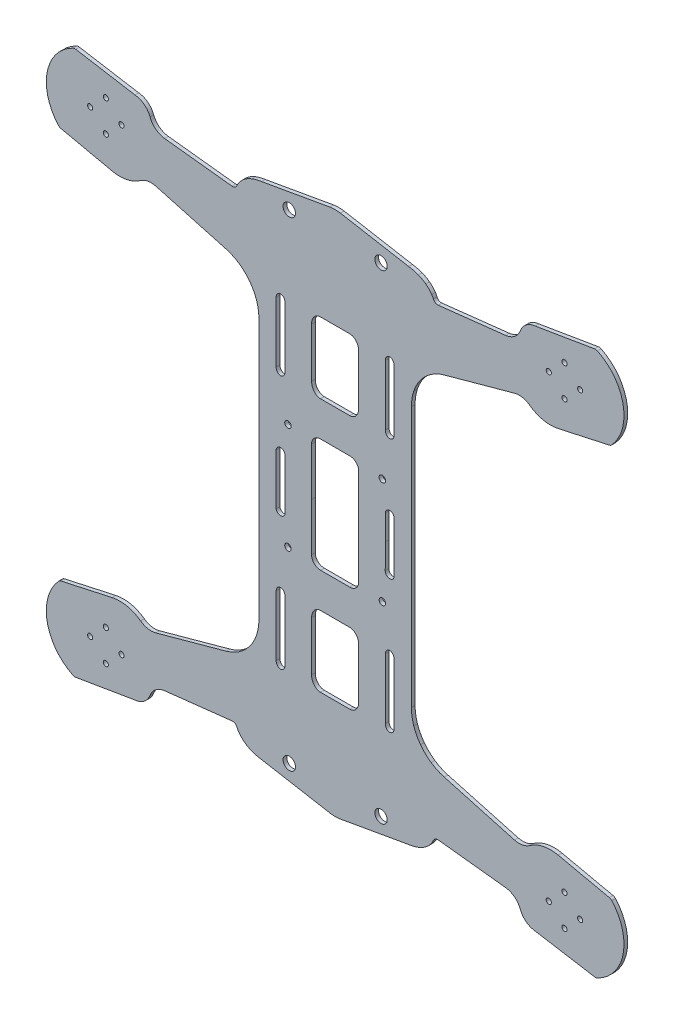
SolidWorks part; units mm, degrees
ref_plane "Спереди" through (0, 0, 0) normal (0, 0, 1) x (1, 0, 0)
ref_plane "Сверху" through (0, 0, 0) normal (0, 1, 0) x (1, 0, 0)
ref_plane "Справа" through (0, 0, 0) normal (1, 0, 0) x (0, 0, -1)
sketch "Эскиз1" plane through (0, 0, 0) normal (0, 0, 1) x (1, 0, 0)
  line L0 (-48.6059, 52.4299) -> (-29.5522, 47.1849)
  line L1 (0, 0) -> (0, 94.9232) construction
  line L2 (-74.3015, 53.0966) -> (-60.4307, 50.0534)
  line L3 (-54.2578, 71.013) -> (-70.2978, 73.7013)
  line L4 (-20.6558, 0) -> (-20.6558, -35.3014)
  line L5 (-15.992, 0) -> (-15.992, -7.0144)
  line L6 (15.992, 6.8016) -> (15.992, 0)
  line L7 (13.592, 0) -> (13.592, 6.8016)
  line L8 (15.992, 42.6106) -> (15.992, 26.2906)
  line L9 (13.592, 26.2906) -> (13.592, 42.6106)
  line L10 (-6.392, 0) -> (-6.3923, -13.0023)
  line L11 (48.6059, -52.4299) -> (29.5522, -47.1849)
  line L12 (1.4357, 71.1085) -> (19.9392, 67.8359)
  line L13 (-3.992, 15.4016) -> (3.992, 15.4016)
  line L14 (74.3015, -53.0966) -> (60.4307, -50.0534)
  line L15 (54.2578, -71.013) -> (70.2978, -73.7013)
  line L16 (6.392, 13.0016) -> (6.392, 0)
  line L17 (46.2218, -64.8102) -> (27.9448, -62.7571)
  line L18 (6.392, -41.1706) -> (6.392, -27.7306)
  line L19 (-3.992, -44.0506) -> (3.992, -44.0506)
  line L20 (-3.992, -24.8506) -> (3.992, -24.8506)
  line L21 (-3.992, 24.8506) -> (3.992, 24.8506)
  line L22 (-3.992, 44.0506) -> (3.992, 44.0506)
  line L23 (-3.9532, -15.4016) -> (3.9532, -15.4016)
  line L24 (6.392, 41.1706) -> (6.392, 27.7306)
  line L25 (46.2218, 64.8102) -> (27.9448, 62.7571)
  line L26 (1.3462, -71.1243) -> (19.9392, -67.8359)
  line L27 (20.6558, 35.3014) -> (20.6558, 0)
  line L28 (13.592, -26.2906) -> (13.592, -42.6106)
  line L29 (15.992, -42.6106) -> (15.992, -26.2906)
  line L30 (13.592, 0) -> (13.5753, -6.731)
  line L31 (6.392, 0) -> (6.3923, -13.0023)
  line L32 (15.992, 0) -> (15.992, -7.0144)
  line L33 (20.6558, 0) -> (20.6558, -35.3014)
  line L34 (-13.592, 0) -> (-13.5753, -6.731)
  line L35 (-15.992, -42.6106) -> (-15.992, -26.2906)
  line L36 (54.2578, 71.013) -> (70.2978, 73.7013)
  line L37 (74.3015, 53.0966) -> (60.4307, 50.0534)
  line L38 (48.6059, 52.4299) -> (29.5522, 47.1849)
  line L39 (-13.592, -26.2906) -> (-13.592, -42.6106)
  line L40 (-20.6558, 35.3014) -> (-20.6558, 0)
  line L41 (-1.3462, -71.1243) -> (-19.9392, -67.8359)
  line L42 (-46.2218, 64.8102) -> (-27.9448, 62.7571)
  line L43 (-6.392, 41.1706) -> (-6.392, 27.7306)
  line L44 (-6.392, -41.1706) -> (-6.392, -27.7306)
  line L45 (-46.2218, -64.8102) -> (-27.9448, -62.7571)
  line L46 (-6.392, 13.0016) -> (-6.392, 0)
  line L47 (-54.2578, -71.013) -> (-70.2978, -73.7013)
  line L48 (0, 0) -> (0, 62.4198) construction
  line L49 (0, 0) -> (0, -77.9632) construction
  line L50 (-74.3015, -53.0966) -> (-60.4307, -50.0534)
  line L51 (-1.4357, 71.1085) -> (-19.9392, 67.8359)
  line L52 (-48.6059, -52.4299) -> (-29.5522, -47.1849)
  line L53 (-13.592, 26.2906) -> (-13.592, 42.6106)
  line L54 (-15.992, 42.6106) -> (-15.992, 26.2906)
  line L55 (-13.592, 0) -> (-13.592, 6.8016)
  line L56 (-15.992, 6.8016) -> (-15.992, 0)
  circle A0 centre (62.15, 62.15) radius 4.25 construction
  circle A1 centre (62.1497, 66.3982) radius 0.7
  circle A2 centre (12.792, 14.4016) radius 0.88
  circle A3 centre (62.15, -62.15) radius 4.25 construction
  circle A4 centre (66.3996, 62.1502) radius 0.7
  circle A5 centre (57.8979, 62.1495) radius 0.7
  arc A6 (54.2578, -71.013) -> (50.1846, -67.906) centre (54.6832, -66.2318) cw
  arc A7 (15.992, 6.8016) -> (13.592, 6.8016) centre (14.792, 6.8016) ccw
  circle A8 centre (12.437, 64.959) radius 1.68
  arc A9 (1.4357, 71.1085) -> (0, 71.2263) centre (0, 62.4198) ccw
  circle A10 centre (62.1498, 57.9) radius 0.7
  arc A11 (6.392, 13.0016) -> (3.992, 15.4016) centre (3.992, 13.0016) ccw
  arc A12 (46.2218, -64.8102) -> (50.1846, -67.906) centre (45.686, -69.5802) cw
  arc A13 (52.711, -51.6782) -> (48.6059, -52.4299) centre (49.8798, -47.802) cw
  arc A14 (26.6179, 63.5428) -> (27.9448, 62.7571) centre (27.8019, 64.0291) ccw
  arc A15 (26.6179, 63.5428) -> (26.1583, 64.4009) centre (22.1961, 61.7266) ccw
  arc A16 (26.1583, 64.4009) -> (24.5827, 66.0547) centre (20.4789, 60.5676) ccw
  arc A17 (24.5827, 66.0547) -> (22.5371, 67.1835) centre (19.4941, 59.2508) ccw
  arc A18 (22.5371, 67.1835) -> (19.9392, 67.8359) centre (18.5376, 56.7573) ccw
  arc A19 (29.5522, 47.1849) -> (26.0037, 45.5429) centre (32.6592, 35.8153) ccw
  arc A20 (26.0037, 45.5429) -> (23.1369, 42.7956) centre (32.8673, 35.5111) ccw
  arc A21 (23.1369, 42.7956) -> (21.2954, 39.2686) centre (33.0435, 35.3792) ccw
  arc A22 (21.2954, 39.2686) -> (20.6558, 35.3014) centre (33.2785, 35.3014) ccw
  arc A23 (52.711, -51.6782) -> (60.4307, -50.0534) centre (58.3734, -59.4304) cw
  arc A24 (74.3015, -53.0966) -> (74.9766, -53.4883) centre (74.0272, -54.3468) cw
  arc A25 (74.9766, -53.4883) -> (71.0679, -73.5906) centre (65.4826, -62.0735) cw
  arc A26 (71.0679, -73.5906) -> (70.2978, -73.7013) centre (70.5094, -72.4389) cw
  arc A27 (21.2954, -39.2686) -> (20.6558, -35.3014) centre (33.2785, -35.3014) cw
  arc A28 (23.1369, -42.7956) -> (21.2954, -39.2686) centre (33.0435, -35.3792) cw
  arc A29 (26.0037, -45.5429) -> (23.1369, -42.7956) centre (32.8673, -35.5111) cw
  arc A30 (29.5522, -47.1849) -> (26.0037, -45.5429) centre (32.6592, -35.8153) cw
  arc A31 (22.5371, -67.1835) -> (19.9392, -67.8359) centre (18.5376, -56.7573) cw
  arc A32 (24.5827, -66.0547) -> (22.5371, -67.1835) centre (19.4941, -59.2508) cw
  arc A33 (26.1583, -64.4009) -> (24.5827, -66.0547) centre (20.4789, -60.5676) cw
  arc A34 (26.6179, -63.5428) -> (26.1583, -64.4009) centre (22.1961, -61.7266) cw
  arc A35 (26.6179, -63.5428) -> (27.9448, -62.7571) centre (27.8019, -64.0291) cw
  arc A36 (6.3923, -13.0023) -> (3.9532, -15.4016) centre (3.992, -13.0016) cw
  circle A37 centre (62.1498, -57.9) radius 0.7
  arc A38 (1.3462, -71.1243) -> (0, -71.2278) centre (0, -62.4198) cw
  circle A39 centre (12.437, -64.959) radius 1.68
  arc A40 (15.992, -7.0144) -> (13.5753, -6.731) centre (14.792, -6.8016) cw
  circle A41 centre (57.8979, -62.1495) radius 0.7
  circle A42 centre (66.3996, -62.1502) radius 0.7
  circle A43 centre (12.792, -14.4016) radius 0.88
  circle A44 centre (62.1497, -66.3982) radius 0.7
  circle A45 centre (-62.15, -62.15) radius 4.25 construction
  circle A46 centre (-62.15, 62.15) radius 4.25 construction
  arc A47 (-54.2578, 71.013) -> (-50.1846, 67.906) centre (-54.6832, 66.2318) cw
  arc A48 (-46.2218, 64.8102) -> (-50.1846, 67.906) centre (-45.686, 69.5802) cw
  arc A49 (-52.711, 51.6782) -> (-48.6059, 52.4299) centre (-49.8798, 47.802) cw
  arc A50 (-52.711, 51.6782) -> (-60.4307, 50.0534) centre (-58.3734, 59.4304) cw
  arc A51 (-74.3015, 53.0966) -> (-74.9766, 53.4883) centre (-74.0272, 54.3468) cw
  arc A52 (-74.9766, 53.4883) -> (-71.0679, 73.5906) centre (-65.4826, 62.0735) cw
  arc A53 (-71.0679, 73.5906) -> (-70.2978, 73.7013) centre (-70.5094, 72.4389) cw
  circle A54 centre (-62.1497, -66.3982) radius 0.7
  circle A55 centre (-12.792, -14.4016) radius 0.88
  circle A56 centre (-66.3996, -62.1502) radius 0.7
  arc A57 (71.0679, 73.5906) -> (70.2978, 73.7013) centre (70.5094, 72.4389) ccw
  arc A58 (74.9766, 53.4883) -> (71.0679, 73.5906) centre (65.4826, 62.0735) ccw
  arc A59 (74.3015, 53.0966) -> (74.9766, 53.4883) centre (74.0272, 54.3468) ccw
  arc A60 (52.711, 51.6782) -> (60.4307, 50.0534) centre (58.3734, 59.4304) ccw
  arc A61 (52.711, 51.6782) -> (48.6059, 52.4299) centre (49.8798, 47.802) ccw
  arc A62 (46.2218, 64.8102) -> (50.1846, 67.906) centre (45.686, 69.5802) ccw
  arc A63 (54.2578, 71.013) -> (50.1846, 67.906) centre (54.6832, 66.2318) ccw
  circle A64 centre (-57.8979, -62.1495) radius 0.7
  arc A65 (-15.992, -7.0144) -> (-13.5753, -6.731) centre (-14.792, -6.8016) ccw
  circle A66 centre (-12.437, -64.959) radius 1.68
  arc A67 (-1.3462, -71.1243) -> (0, -71.2278) centre (0, -62.4198) ccw
  circle A68 centre (-62.1498, -57.9) radius 0.7
  arc A69 (-6.3923, -13.0023) -> (-3.9532, -15.4016) centre (-3.992, -13.0016) ccw
  arc A70 (-26.6179, -63.5428) -> (-27.9448, -62.7571) centre (-27.8019, -64.0291) ccw
  arc A71 (-26.6179, -63.5428) -> (-26.1583, -64.4009) centre (-22.1961, -61.7266) ccw
  arc A72 (-26.1583, -64.4009) -> (-24.5827, -66.0547) centre (-20.4789, -60.5676) ccw
  arc A73 (-24.5827, -66.0547) -> (-22.5371, -67.1835) centre (-19.4941, -59.2508) ccw
  arc A74 (-22.5371, -67.1835) -> (-19.9392, -67.8359) centre (-18.5376, -56.7573) ccw
  arc A75 (-29.5522, -47.1849) -> (-26.0037, -45.5429) centre (-32.6592, -35.8153) ccw
  arc A76 (-26.0037, -45.5429) -> (-23.1369, -42.7956) centre (-32.8673, -35.5111) ccw
  arc A77 (-23.1369, -42.7956) -> (-21.2954, -39.2686) centre (-33.0435, -35.3792) ccw
  arc A78 (-21.2954, -39.2686) -> (-20.6558, -35.3014) centre (-33.2785, -35.3014) ccw
  arc A79 (-71.0679, -73.5906) -> (-70.2978, -73.7013) centre (-70.5094, -72.4389) ccw
  arc A80 (-74.9766, -53.4883) -> (-71.0679, -73.5906) centre (-65.4826, -62.0735) ccw
  arc A81 (-74.3015, -53.0966) -> (-74.9766, -53.4883) centre (-74.0272, -54.3468) ccw
  arc A82 (-52.711, -51.6782) -> (-60.4307, -50.0534) centre (-58.3734, -59.4304) ccw
  arc A83 (-21.2954, 39.2686) -> (-20.6558, 35.3014) centre (-33.2785, 35.3014) cw
  arc A84 (-23.1369, 42.7956) -> (-21.2954, 39.2686) centre (-33.0435, 35.3792) cw
  arc A85 (-26.0037, 45.5429) -> (-23.1369, 42.7956) centre (-32.8673, 35.5111) cw
  arc A86 (-29.5522, 47.1849) -> (-26.0037, 45.5429) centre (-32.6592, 35.8153) cw
  arc A87 (-22.5371, 67.1835) -> (-19.9392, 67.8359) centre (-18.5376, 56.7573) cw
  arc A88 (-24.5827, 66.0547) -> (-22.5371, 67.1835) centre (-19.4941, 59.2508) cw
  arc A89 (-26.1583, 64.4009) -> (-24.5827, 66.0547) centre (-20.4789, 60.5676) cw
  arc A90 (-26.6179, 63.5428) -> (-26.1583, 64.4009) centre (-22.1961, 61.7266) cw
  arc A91 (-26.6179, 63.5428) -> (-27.9448, 62.7571) centre (-27.8019, 64.0291) cw
  arc A92 (-52.711, -51.6782) -> (-48.6059, -52.4299) centre (-49.8798, -47.802) ccw
  arc A93 (-46.2218, -64.8102) -> (-50.1846, -67.906) centre (-45.686, -69.5802) ccw
  arc A94 (-6.392, 13.0016) -> (-3.992, 15.4016) centre (-3.992, 13.0016) cw
  circle A95 centre (-62.1498, 57.9) radius 0.7
  arc A96 (-1.4357, 71.1085) -> (0, 71.2263) centre (0, 62.4198) cw
  circle A97 centre (-12.437, 64.959) radius 1.68
  arc A98 (-15.992, 6.8016) -> (-13.592, 6.8016) centre (-14.792, 6.8016) cw
  arc A99 (-54.2578, -71.013) -> (-50.1846, -67.906) centre (-54.6832, -66.2318) ccw
  circle A100 centre (-57.8979, 62.1495) radius 0.7
  circle A101 centre (-66.3996, 62.1502) radius 0.7
  circle A102 centre (-12.792, 14.4016) radius 0.88
  circle A103 centre (-62.1497, 66.3982) radius 0.7
  ellipse E0 centre (3.992, -41.1706) end of major axis (3.992, -38.2906) minor radius 2.4 (6.392, -41.1706) -> (3.992, -44.0506) cw
  ellipse E1 centre (3.992, -27.7306) end of major axis (3.992, -24.8506) minor radius 2.4 (3.992, -24.8506) -> (6.392, -27.7306) cw
  ellipse E2 centre (14.792, -42.6106) end of major axis (14.792, -41.1706) minor radius 1.2 (15.992, -42.6106) -> (13.592, -42.6106) cw
  ellipse E3 centre (14.792, -26.2906) end of major axis (14.792, -24.8506) minor radius 1.2 (13.592, -26.2906) -> (15.992, -26.2906) cw
  ellipse E4 centre (14.792, 26.2906) end of major axis (14.792, 27.7306) minor radius 1.2 (13.592, 26.2906) -> (15.992, 26.2906) ccw
  ellipse E5 centre (14.792, 42.6106) end of major axis (14.792, 44.0506) minor radius 1.2 (15.992, 42.6106) -> (13.592, 42.6106) ccw
  ellipse E6 centre (-3.992, 41.1706) end of major axis (-3.992, 38.2906) minor radius 2.4 (-6.392, 41.1706) -> (-3.992, 44.0506) cw
  ellipse E7 centre (-3.992, 27.7306) end of major axis (-3.992, 24.8506) minor radius 2.4 (-3.992, 24.8506) -> (-6.392, 27.7306) cw
  ellipse E8 centre (-14.792, 42.6106) end of major axis (-14.792, 41.1706) minor radius 1.2 (-15.992, 42.6106) -> (-13.592, 42.6106) cw
  ellipse E9 centre (-14.792, 26.2906) end of major axis (-14.792, 24.8506) minor radius 1.2 (-13.592, 26.2906) -> (-15.992, 26.2906) cw
  ellipse E10 centre (-14.792, -26.2906) end of major axis (-14.792, -24.8506) minor radius 1.2 (-13.592, -26.2906) -> (-15.992, -26.2906) ccw
  ellipse E11 centre (-14.792, -42.6106) end of major axis (-14.792, -41.1706) minor radius 1.2 (-15.992, -42.6106) -> (-13.592, -42.6106) ccw
  ellipse E12 centre (-3.992, -27.7306) end of major axis (-3.992, -24.8506) minor radius 2.4 (-3.992, -24.8506) -> (-6.392, -27.7306) ccw
  ellipse E13 centre (3.992, 27.7306) end of major axis (3.992, 24.8506) minor radius 2.4 (3.992, 24.8506) -> (6.392, 27.7306) ccw
  ellipse E14 centre (-3.992, -41.1706) end of major axis (-3.992, -38.2906) minor radius 2.4 (-6.392, -41.1706) -> (-3.992, -44.0506) ccw
  ellipse E15 centre (3.992, 41.1706) end of major axis (3.992, 44.0506) minor radius 2.4 (6.392, 41.1706) -> (3.992, 44.0506) ccw
  point P1 (0.0016, 0.0016)
  point P2 (0.0016, 0)
  point P127 (0, -24.8506)
  point P140 (0, 24.8506)
  point P174 (0, -44.0506)
  point P176 (0, 44.0506)
  point P383 (0, -15.4016)
  point P384 (0, 15.4016)
  point P386 (-0.0016, 0)
  point P387 (-0.0016, 0.0016)
extrude "Бобышка-Вытянуть3" add sketch "Эскиз1" along normal blind 1
